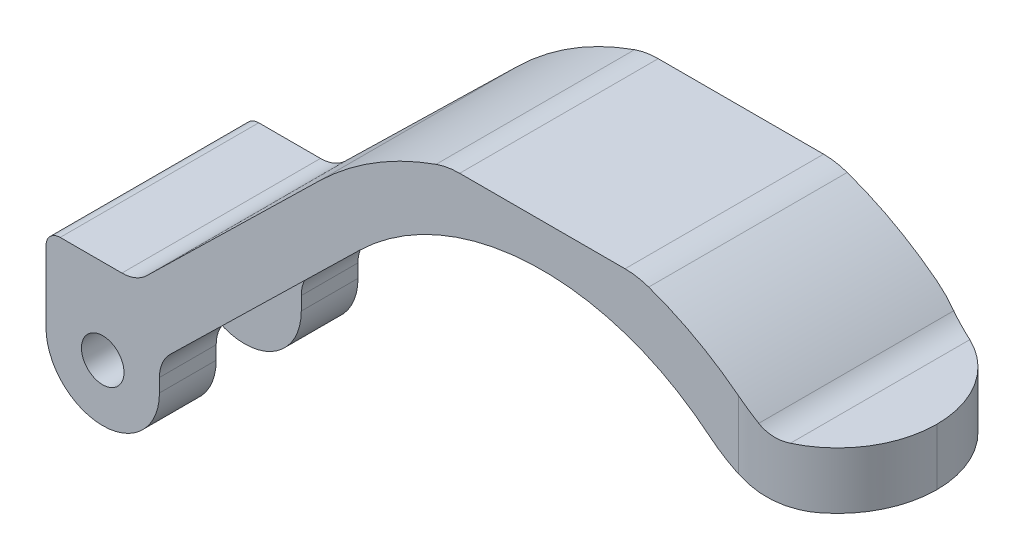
SolidWorks part; units mm, degrees
ref_plane "Alzado" through (0, 0, 0) normal (0, 0, 1) x (1, 0, 0)
ref_plane "Planta" through (0, 0, 0) normal (0, 1, 0) x (1, 0, 0)
ref_plane "Vista lateral" through (0, 0, 0) normal (1, 0, 0) x (0, 0, -1)
sketch "Croquis1" plane through (0, 0, 0) normal (0, 0, 1) x (1, 0, 0)
  line L0 (28.1603, 24) -> (41.6386, 24)
  line L1 (41.6386, 24) -> (41.6386, 32)
  line L2 (41.6386, 32) -> (31.6386, 32)
  line L3 (-25.8422, 26.4798) -> (-54, -1)
  line L4 (-54, -1) -> (-54, -5)
  line L5 (-70, -5) -> (-70, 7)
  line L6 (-70, 7) -> (-57.2567, 7)
  line L7 (-57.2567, 7) -> (-31.4297, 32.2052)
  arc A0 (31.6386, 32) -> (-31.4297, 32.2052) centre (0, 0) ccw
  arc A1 (28.1603, 24) -> (-25.8422, 26.4798) centre (0, 0) ccw
  arc A2 (-54, -5) -> (-70, -5) centre (-62, -5) cw
  dimension "D1" = 90
  dimension "D2" = 8
  dimension "D6" = 8
  dimension "D3" = 8
  dimension "D4" = 8
  dimension "D5" = 8
  dimension "D7" = 4
  dimension "D8" = 5
  dimension "D9" = 62
  dimension "D10" = 10
  dimension "D11" = 24
extrude "Saliente-Extruir1" add sketch "Croquis1" along normal blind 28
sketch "Croquis2" plane through (-70, 0, 0) normal (-1, 0, 0) x (0, 0, 1)
  line L0 (0, -13) -> (28, -13) construction
  line L1 (8, -13) -> (20, -13)
  line L2 (8, -13) -> (8, 3)
  line L3 (8, 3) -> (20, 3)
  line L4 (20, -13) -> (20, 3)
  line L5 (14, 3) -> (14, 32.2052) construction
  line L6 (28, 32.2052) -> (0, 32.2052) construction
  line L7 (28, -13) -> (28, -5) construction
  dimension "D1" = 8
  dimension "D2" = 16
extrude "Cortar-Extruir1" cut sketch "Croquis2" against normal blind 28
sketch "Croquis3" plane through (0, 0, 28) normal (0, 0, 1) x (1, 0, 0)
  circle A0 centre (-62, -5) radius 3
  dimension "D1" = 6
extrude "Cortar-Extruir2" cut sketch "Croquis3" against normal blind 28
fillet "Redondeo1" radius 14 2 edges at (41.6386, 28, 28) (41.6386, 28, 0)
fillet "Redondeo2" radius 5 2 edges at (31.6386, 32, 14) (-57.2567, 7, 14)
fillet "Redondeo3" radius 20 1 edges at (28.1603, 24, 14)
fillet "Redondeo4" radius 5 2 edges at (-54, -1, 4) (-54, -1, 24)
fillet "Redondeo5" radius 2 2 edges at (-49.9013, 3, 14) (-70, 7, 14)
sketch "Croquis4" plane through (0, 0, 28) normal (0, 0, 1) x (1, 0, 0)
  line L1 (-13.2665, 43) -> (13.2665, 43)
  line L2 (-13.2665, 43) -> (-13.2665, 53)
  line L3 (-13.2665, 53) -> (13.2665, 53)
  line L4 (13.2665, 43) -> (13.2665, 53)
  circle A1 centre (-62, -5) radius 3 construction
  arc A2 (27.6386, 35.5121) -> (-31.4297, 32.2052) centre (0, 0) ccw construction
  dimension "D1" = 10
  dimension "D2" = 48
extrude "Cortar-Extruir3" cut sketch "Croquis4" against normal blind 28
fillet "Redondeo6" radius 10 2 edges at (13.2665, 43, 14) (-13.2665, 43, 14)
